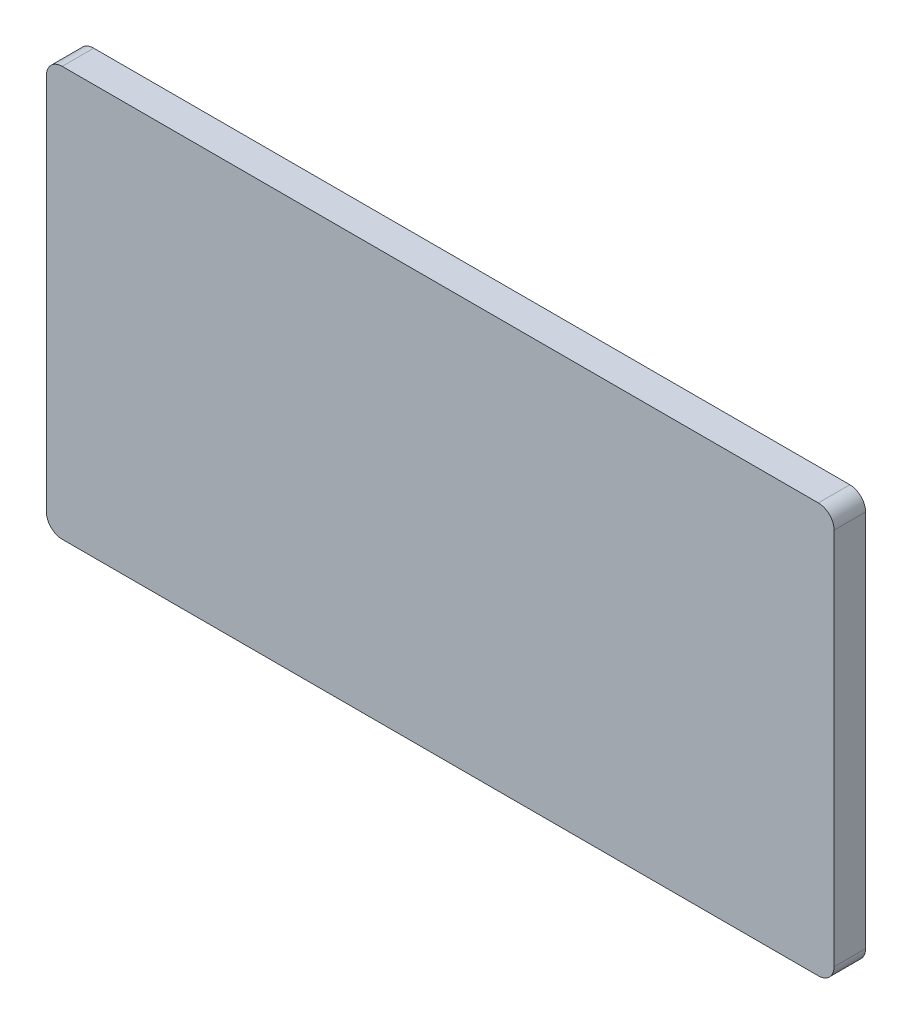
SolidWorks part; units mm, degrees
ref_plane "Plan de face" through (0, 0, 0) normal (0, 0, 1) x (1, 0, 0)
ref_plane "Plan de dessus" through (0, 0, 0) normal (0, 1, 0) x (1, 0, 0)
ref_plane "Plan de droite" through (0, 0, 0) normal (1, 0, 0) x (0, 0, -1)
sketch "Esquisse1" plane through (0, 0, 0) normal (0, 0, 1) x (1, 0, 0)
  line L1 (-25, 13) -> (25, 13)
  line L2 (-25, 13) -> (-25, -13)
  line L3 (-25, -13) -> (25, -13)
  line L4 (25, 13) -> (25, -13)
  dimension "D1" = 50
  dimension "D2" = 26
  dimension "D3" = 25
  dimension "D4" = 13
extrude "Extrusion1" add sketch "Esquisse1" along normal blind 2
fillet "Congé1" radius 1 4 edges at (25, -13, 1) (25, 13, 1) (-25, -13, 1) (-25, 13, 1)
